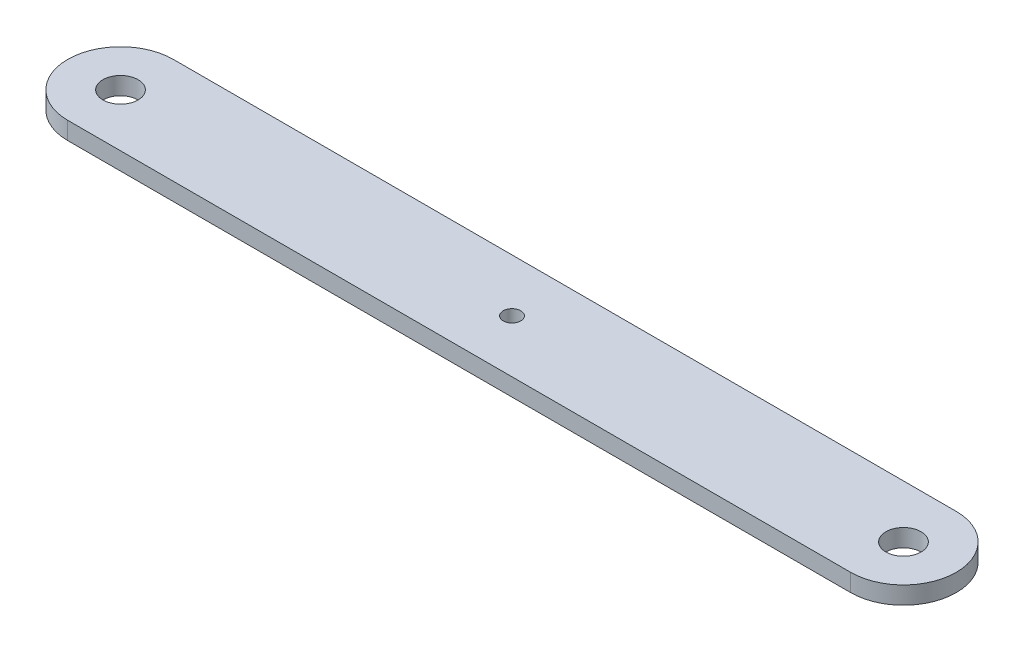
SolidWorks part; units mm, degrees
ref_plane "Front Plane" through (0, 0, 0) normal (0, 0, 1) x (1, 0, 0)
ref_plane "Top Plane" through (0, 0, 0) normal (0, 1, 0) x (1, 0, 0)
ref_plane "Right Plane" through (0, 0, 0) normal (1, 0, 0) x (0, 0, -1)
sketch "Sketch1" plane through (0, 0, 0) normal (0, 1, 0) x (1, 0, 0)
  line L1 (-141.2875, -19.05) -> (141.2875, -19.05)
  line L3 (-141.2875, 19.05) -> (141.2875, 19.05)
  line L5 (-141.2875, -19.05) -> (141.2875, 19.05) construction
  line L6 (-141.2875, 19.05) -> (141.2875, -19.05) construction
  arc A0 (-141.2875, 19.05) -> (-141.2875, -19.05) centre (-141.2875, 0) ccw
  arc A1 (141.2875, 19.05) -> (141.2875, -19.05) centre (141.2875, 0) cw
  point P0 (0, 0)
  dimension "D1" = 282.575
  dimension "D2" = 38.1
extrude "Boss-Extrude1" add sketch "Sketch1" along normal mid plane 6.35
sketch "Sketch2" plane through (0, 3.175, 0) normal (0, 1, 0) x (1, 0, 0)
  line L0 (0, -19.05) -> (0, 19.05) construction
  line L1 (-141.2875, -19.05) -> (141.2875, -19.05) construction
  line L2 (-141.2875, 19.05) -> (141.2875, 19.05) construction
  circle A0 centre (-141.2875, 0) radius 6.35
  circle A1 centre (141.2875, 0) radius 6.35
  circle A2 centre (0, 0) radius 3.175
  dimension "D1" = 12.7
  dimension "D2" = 6.35
extrude "Cut-Extrude1" cut sketch "Sketch2" along direction (0, -1, 0) on the side against the normal through all
